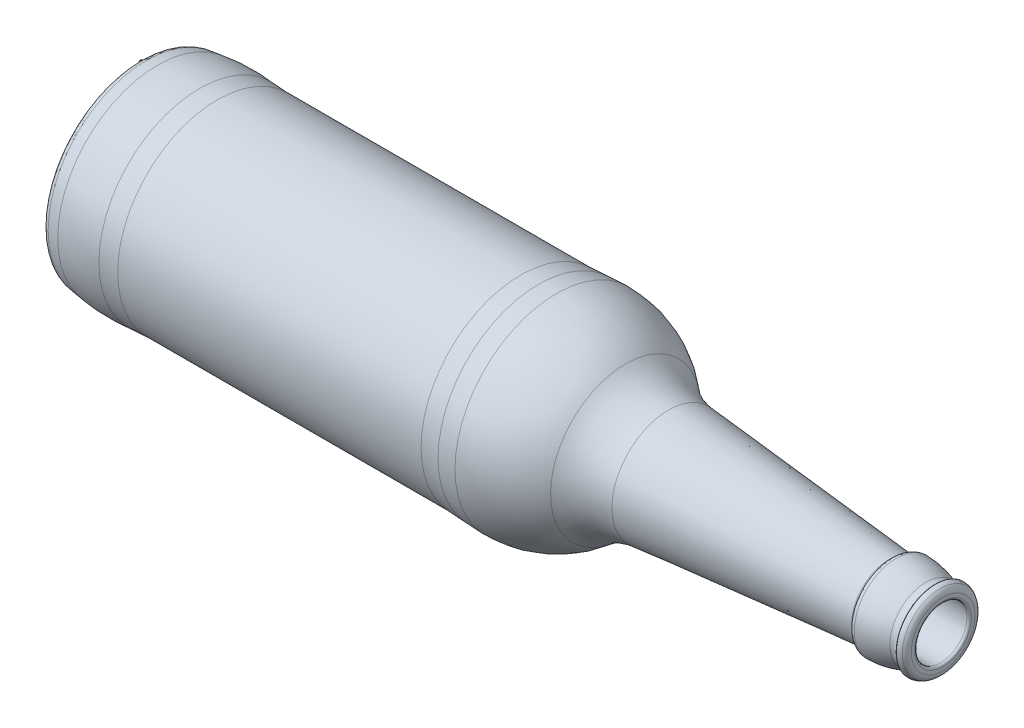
SolidWorks part; units mm, degrees
ref_plane "Ebene vorne" through (0, 0, 0) normal (0, 0, 1) x (1, 0, 0)
ref_plane "Ebene oben" through (0, 0, 0) normal (0, 1, 0) x (1, 0, 0)
ref_plane "Ebene rechts" through (0, 0, 0) normal (1, 0, 0) x (0, 0, -1)
sketch "Skizze1" plane through (0, 0, 0) normal (0, 0, 1) x (1, 0, 0)
  line L0 (0, 0) -> (282.9225, 0) construction
  line L1 (270, 53.4209) -> (270, -50.5608) construction
  line L2 (183.9649, 65.9182) -> (183.9649, -41.2203) construction
  line L3 (128, 30.4985) -> (26, 30.4985)
  line L4 (251.4349, 9.4647) -> (177.4131, 16.0314)
  line L5 (251.6168, 9.453) -> (269.2201, 8.7506)
  line L6 (3.5, 0) -> (6.5, 0)
  line L7 (3.11, 30.1435) -> (6.316, 30.5797) construction
  line L11 (270, 10.7) -> (270, 9.5)
  line L12 (267.5, 10.7) -> (267.5, 13.2) construction
  line L15 (251.7, 12.4529) -> (177.6782, 19.0196)
  line L17 (2.163, 33.0423) -> (5.9115, 33.5523)
  line L19 (128, 33.4985) -> (26, 33.4985)
  line L20 (266.265, 9.0497) -> (266.265, 9.0497) construction
  arc A0 (3.5, 0) -> (0.0647, 30) centre (-129.2111, 0) ccw
  arc A1 (20, 33.7992) -> (5.9115, 33.5523) centre (14, -25.9) ccw
  arc A2 (20, 33.7992) -> (26, 33.4985) centre (26, 93.4985) ccw
  arc A3 (2.163, 33.0423) -> (0.0647, 30) centre (2.5, 30.5651) ccw
  arc A4 (163.2676, 25.2461) -> (140, 34.1) centre (140, -0.9) ccw
  arc A5 (128, 33.4985) -> (134, 33.7992) centre (128, 93.4985) ccw
  arc A6 (270, 10.7) -> (267.5, 13.2) centre (267.5, 10.7) ccw
  arc A8 (264.232, 12.1545) -> (267.3313, 13.1074) centre (265.2224, 14.45) ccw
  arc A9 (267.5, 13.2) -> (267.3313, 13.1074) centre (267.5, 13) ccw
  arc A10 (264.232, 12.1545) -> (254.328, 14.2) centre (254.328, -10.8) ccw
  arc A11 (254.328, 14.2) -> (252.4649, 12.9273) centre (254.328, 12.2) ccw
  arc A12 (251.7, 12.4529) -> (252.4649, 12.9273) centre (251.7663, 13.2) ccw
  arc A13 (163.2676, 25.2461) -> (177.6782, 19.0196) centre (179.8874, 43.9218) ccw
  arc A14 (140, 34.1) -> (134, 33.7992) centre (140, -25.9) ccw
  arc A15 (6.5, 0) -> (4.1869, 24.9496) centre (-129.2111, 0) ccw
  arc A16 (269.2201, 8.7506) -> (270, 9.5) centre (269.25, 9.5) ccw
  arc A17 (19.7, 30.8143) -> (8.6307, 30.8465) centre (14, -25.9) ccw
  arc A18 (19.7, 30.8143) -> (26, 30.4985) centre (26, 93.4985) ccw
  arc A19 (128, 30.4985) -> (134.3, 30.8143) centre (128, 93.4985) ccw
  arc A20 (140, 31.1) -> (134.3, 30.8143) centre (140, -25.9) ccw
  arc A21 (161.2733, 23.005) -> (140, 31.1) centre (140, -0.9) ccw
  arc A22 (161.2733, 23.005) -> (177.4131, 16.0314) centre (179.8874, 43.9218) ccw
  arc A23 (251.4349, 9.4647) -> (251.6168, 9.453) centre (251.7663, 13.2) ccw
  arc A24 (19.7, 30.8143) -> (6.316, 30.5797) centre (14, -25.9) ccw construction
  arc A30 (8.6307, 30.8465) -> (4.1869, 24.9496) centre (9.1017, 25.8688) ccw
  arc A31 (251.4349, 9.4647) -> (254.9332, 11.1917) centre (251.7663, 13.2) ccw construction
  arc A32 (6.5, 0) -> (3.11, 30.1435) centre (-129.2111, 0) ccw construction
  arc A33 (3.11, 30.1435) -> (3.11, 30.1435) centre (3.11, 30.1435) ccw construction
  arc A34 (263.0435, 9.4) -> (254.9332, 11.1917) centre (254.328, -10.8) ccw construction
  arc A35 (254.9332, 11.1917) -> (254.9332, 11.1917) centre (254.9332, 11.1917) ccw construction
  arc A36 (263.0435, 9.4) -> (266.265, 9.0497) centre (265.2224, 14.45) ccw construction
  arc A37 (266.265, 9.0497) -> (266.265, 9.0497) centre (266.265, 9.0497) ccw construction
  arc A38 (266.265, 9.0497) -> (266.265, 9.0497) centre (266.265, 9.0497) ccw construction
  arc A39 (266.265, 9.0497) -> (266.265, 9.0497) centre (266.265, 9.0497) cw construction
  arc A40 (269.25, 8.75) -> (270, 9.5) centre (269.25, 9.5) ccw construction
  point P37 (3.5, 0)
  point P83 (183.9649, 18.4619)
  dimension "D12" = 2.5
  dimension "D14" = 60
  dimension "D15" = 14
  dimension "D16" = 25.9
  dimension "D17" = 120
  dimension "D7" = 128
  dimension "D11" = 5
  dimension "D20" = 0.75
  dimension "D23" = 5
  dimension "D24" = 0.4
  dimension "D25" = 50
  dimension "D27" = 4
  dimension "D28" = 1.5
  dimension "D29" = 60
  dimension "D18" = 21.4
  dimension "D31" = 18.3
  dimension "D32" = 25
  dimension "D34" = 35
  dimension "D37" = 10
  dimension "D1" = 270
  dimension "D4" = 68.5
  dimension "D5" = 19
  dimension "D6" = 25.9
  dimension "D8" = 140
  dimension "D9" = 3.5
  dimension "D10" = 0.0647
  dimension "D13" = 60
  dimension "D19" = 4.7776
  dimension "D21" = 15.672
  dimension "D22" = 24.4
  dimension "D26" = 15.672
  dimension "D30" = 66.997
  dimension "D33" = 18.2337
  dimension "D35" = 140
  dimension "D36" = 3
  dimension "D38" = 36.9239
  dimension "D39" = 17.5012
  dimension "D40" = 28.9
  dimension "D41" = 26.4
revolve "Rotation2" add sketch "Skizze1" angle 360 about L0
ref_plane "Ebene1" through (-0.25, 0, 0) normal (1, 0, 0) x (0, 0, -1)
sketch "Skizze2" plane through (-0.25, 0, 0) normal (1, 0, 0) x (0, 0, -1)
  line L0 (0, 31) -> (0, 0) construction
  line L1 (0.075, 29.7) -> (-0.075, 29.7)
  line L2 (0.375, 30) -> (0.375, 32)
  line L3 (0.075, 32.3) -> (-0.075, 32.3)
  line L4 (-0.375, 30) -> (-0.375, 32)
  line L5 (0.375, 29.7) -> (-0.375, 32.3) construction
  line L6 (0.375, 32.3) -> (-0.375, 29.7) construction
  arc A4 (0.075, 29.7) -> (0.375, 30) centre (0.075, 30) ccw
  arc A5 (-0.075, 29.7) -> (-0.375, 30) centre (-0.075, 30) cw
  arc A6 (-0.075, 32.3) -> (-0.375, 32) centre (-0.075, 32) ccw
  arc A7 (0.375, 32) -> (0.075, 32.3) centre (0.075, 32) ccw
  point P0 (0, 31)
  dimension "D2" = 0.3
  dimension "D1" = 0.75
  dimension "D3" = 31
  dimension "D4" = 2
extrude "Aufsatz-Linear austragen1" add sketch "Skizze2" along normal up to surface (0.4044 mm away)
sketch "Skizze3" plane through (0, 0, 0) normal (0, 0, 1) x (1, 0, 0)
  line L0 (2.25, 33.3) -> (-0.25, 33.3)
  line L1 (-0.25, -37.51) -> (-0.25, 37.51) construction
  line L2 (-0.25, 33.3) -> (-0.25, 30.8)
  line L3 (0.7, 32.3) -> (-0.25, 32.3) construction
  arc A0 (2.25, 33.3) -> (-0.25, 30.8) centre (2.25, 30.8) ccw
  dimension "D3" = 5
  dimension "D2" = 1
revolve "Schnitt-Rotation1" cut sketch "Skizze3" angle 5 mid plane about axis through (0, 0, 0) along (-1, 0, 0)
fillet "Verrundung1" radius 0.2 10 edges at (0.6299, 32.2231, -0.2756) (4.9809, 30.2543, -0.375) (4.8616, 29.7425, 0.375) (0.6623, 32.2593, 0.2259) (0.1088, 29.8077, -0.3052) (0.134, 29.7, 0) (0.1193, 29.7628, 0.2586)
fillet "Verrundung2" radius 0.25 8 edges at (-0.25, 29.7879, -0.2871) (-0.25, 29.7, 0) (-0.25, 29.7879, 0.2871) (-0.1622, 31.4545, 0.375) (0.2162, 32.253, 0.2362) (4.1763, 32.3, -2.4602) (0.1956, 32.2234, -0.2752)
sketch "Skizze4" plane through (0, 0, 0) normal (0, 0, 1) x (1, 0, 0)
  line L0 (269, 21.285) -> (269, -19.2457)
  line L1 (270, -10.7) -> (270, 10.7) construction
  dimension "D1" = 1
pattern_circular "Kreismuster7" [suppressed] count 75 over 360
